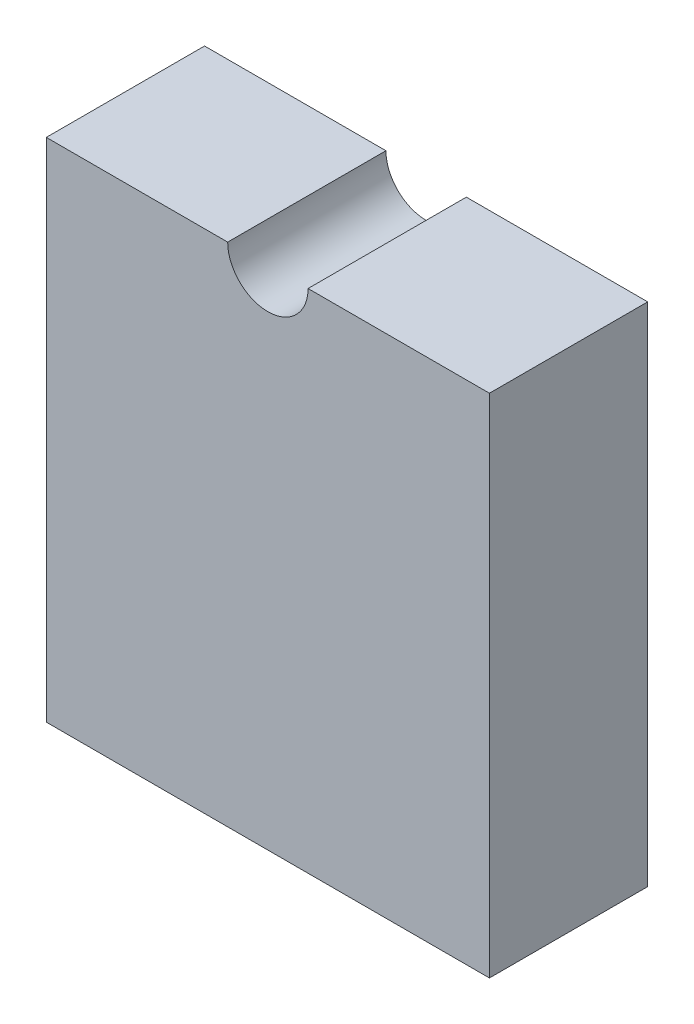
SolidWorks part; units mm, degrees
ref_plane "Front Plane" through (0, 0, 0) normal (0, 0, 1) x (1, 0, 0)
ref_plane "Top Plane" through (0, 0, 0) normal (0, 1, 0) x (1, 0, 0)
ref_plane "Right Plane" through (0, 0, 0) normal (1, 0, 0) x (0, 0, -1)
sketch "Sketch2" plane through (0, 0, 0) normal (0, 1, 0) x (1, 0, 0)
  line L0 (-35, 0) -> (35, 0)
  line L2 (-35, 0) -> (-35, -25)
  line L3 (-35, -25) -> (35, -25)
  line L4 (35, 0) -> (35, -25)
  line L5 (0, 0) -> (35, -25) construction
  line L6 (-35, -25) -> (0, 0) construction
  line L7 (-35, 20.0732) -> (-35, 0) construction
  line L8 (35, 20.0732) -> (35, 0) construction
  line L9 (-35, 20.0732) -> (35, 20.0732) construction
  arc A0 (-15, 0) -> (15, 0) centre (0, 0) ccw
  point P0 (0, 0)
  point P9 (0, 0)
  dimension "D1" = 30
  dimension "D2" = 25
  dimension "D3" = 35
extrude "Boss-Extrude2" add sketch "Sketch2" against normal blind 50 separate body contours A0 L0 L2 L3 L4
sketch "Sketch3" plane through (0, 0, 25) normal (0, 0, 1) x (1, 0, 0)
  line L0 (-35, 0) -> (-35, 30)
  line L1 (-35, 30) -> (35, 30)
  line L2 (35, 30) -> (35, 0)
  line L3 (35, 0) -> (-35, 0)
  line L4 (35, -50) -> (35, 0) construction
  line L5 (-35, -50) -> (-35, 0) construction
  arc A0 (-6.35, 30) -> (6.35, 30) centre (0, 30) ccw
  dimension "D1" = 12.7
  dimension "D2" = 30
extrude "Boss-Extrude3" add sketch "Sketch3" against normal up to surface (25 mm away) contours A0 L1 L0 L2 M6
